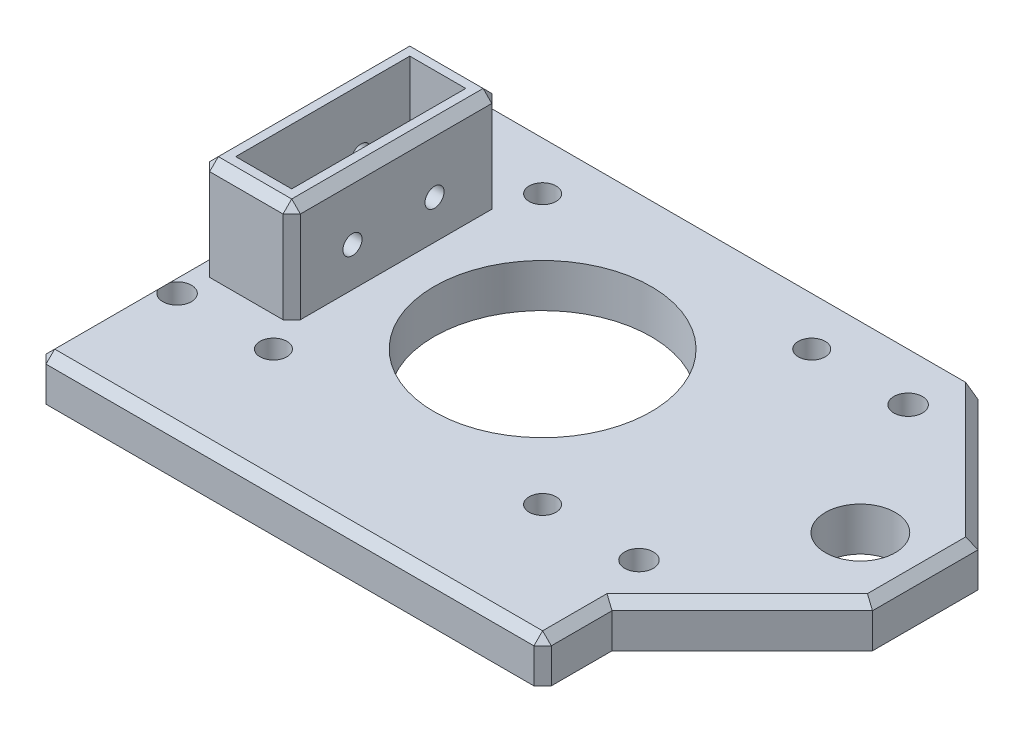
SolidWorks part; units mm, degrees
ref_plane "Alzado" through (0, 0, 0) normal (0, 0, 1) x (1, 0, 0)
ref_plane "Planta" through (0, 0, 0) normal (0, 1, 0) x (1, 0, 0)
ref_plane "Vista lateral" through (0, 0, 0) normal (1, 0, 0) x (0, 0, -1)
sketch "Croquis1" plane through (0, 10.1619, 0) normal (0, 1, 0) x (1, 0, 0)
  line L1 (26.3958, -1000.05) -> (-31.8042, -1000.05)
  line L2 (26.3958, -1000.05) -> (26.3958, -1050.2)
  line L3 (26.3958, -1050.2) -> (-31.8042, -1050.2)
  line L4 (-31.8042, -1000.05) -> (-31.8042, -1050.2)
  line L8 (25.3958, -1050.2) -> (-30.8042, -1050.2) construction
  line L9 (-26.8042, -1000.05) -> (-31.8042, -1000.05) construction
  line L10 (26.3958, -1049.2) -> (26.3958, -1000.05) construction
  line L11 (-31.8042, -1049.2) -> (-31.8042, -1000.05) construction
  circle A0 centre (-2.7042, -1021.1) radius 12.5
  dimension "D1" = 25
extrude "Saliente-Extruir1" add sketch "Croquis1" along normal blind 5
sketch "Croquis2" plane through (0, 15.1619, 0) normal (0, 1, 0) x (1, 0, 0)
  circle A0 centre (-29.3042, -1005.6) radius 1.65
  circle A1 centre (-29.3042, -1036.6) radius 1.65
  circle A2 centre (23.8958, -1005.6) radius 1.65
  circle A3 centre (23.8958, -1036.6) radius 1.65
  dimension "D1" = 3.3
  dimension "D2" = 3.3
  dimension "D3" = 3.3
  dimension "D4" = 3.3
extrude "Cortar-Extruir1" cut sketch "Croquis2" against normal up to next
sketch "Croquis3" plane through (0, 15.1619, 0) normal (0, 1, 0) x (1, 0, 0)
  line L8 (13.4673, -1042.2) -> (-18.8758, -1042.2) construction
  line L9 (26.3958, -1050.2) -> (26.3958, -1000.05) construction
  line L10 (26.3958, -1042.2) -> (26.3958, -1000.05)
  line L11 (26.3958, -1042.2) -> (41.3958, -1027.2)
  line L12 (41.3958, -1027.2) -> (41.3958, -1015.05)
  line L13 (41.3958, -1015.05) -> (26.3958, -1000.05)
  circle A1 centre (33.8958, -1021.1) radius 4.025
  dimension "D9" = 8.05
  dimension "D6" = 15
  dimension "D7" = 45
  dimension "D8" = 45
  dimension "D10" = 7.5
extrude "Saliente-Extruir2" add sketch "Croquis3" against normal up to vertex
chamfer "Chaflán2" distance 1 angle 45 8 edges at (26.3958, 15.1619, 1046.2) (-31.8042, 12.6619, 1050.2) (-31.8042, 15.1619, 1025.125) (-2.7042, 15.1619, 1050.2) (26.3958, 12.6619, 1050.2) (33.8958, 15.1619, 1007.55) (41.3958, 15.1619, 1021.125) (33.8958, 15.1619, 1034.7)
ref_plane "Plano1" through (-23.7542, 3.1619, 1035.1195) normal (0, 0, 1) x (1, 0, 0)
sketch "Croquis7" plane through (0, 15.1619, 0) normal (0, 1, 0) x (1, 0, 0)
  circle A0 centre (-18.2042, -1005.6) radius 1.55
  circle A1 centre (12.7958, -1005.6) radius 1.55
  circle A2 centre (-18.2042, -1036.6) radius 1.55
  circle A3 centre (12.7958, -1036.6) radius 1.55
  dimension "D1" = 3.1
  dimension "D2" = 3.1
  dimension "D3" = 3.1
  dimension "D4" = 3.1
extrude "Cortar-Extruir2" cut sketch "Croquis7" against normal up to next
sketch "Croquis8" plane through (0, 15.1619, 0) normal (0, 1, 0) x (1, 0, 0)
  line L0 (-31.8042, -1049.2) -> (-31.8042, -1000.05) construction
  line L1 (-28.0292, -1031.125) -> (-21.5792, -1031.125)
  line L2 (-28.0292, -1031.125) -> (-28.0292, -1011.075)
  line L3 (-28.0292, -1011.075) -> (-21.5792, -1011.075)
  line L4 (-21.5792, -1031.125) -> (-21.5792, -1011.075)
  line L5 (-28.0292, -1031.125) -> (-21.5792, -1011.075) construction
  line L6 (-28.0292, -1011.075) -> (-21.5792, -1031.125) construction
  line L8 (-30.0292, -1033.125) -> (-19.5792, -1033.125)
  line L9 (-30.0292, -1033.125) -> (-30.0292, -1009.075)
  line L10 (-30.0292, -1009.075) -> (-19.5792, -1009.075)
  line L11 (-19.5792, -1033.125) -> (-19.5792, -1009.075)
  line L12 (-30.0292, -1033.125) -> (-19.5792, -1009.075) construction
  line L13 (-30.0292, -1009.075) -> (-19.5792, -1033.125) construction
  point P0 (-24.8042, -1021.1)
  point P16 (-24.8042, -1021.1)
  dimension "D1" = 6.45
  dimension "D2" = 20.05
  dimension "D3" = 7
  dimension "D4" = 2
  dimension "D5" = 2
extrude "Saliente-Extruir4" add sketch "Croquis8" along normal blind 11.55
sketch "Croquis10" plane through (0, 15.1619, 0) normal (0, 1, 0) x (1, 0, 0)
  line L4 (-28.0292, -1011.075) -> (-28.0292, -1031.125)
  line L5 (-28.0292, -1031.125) -> (-21.5792, -1031.125)
  line L6 (-21.5792, -1031.125) -> (-21.5792, -1011.075)
  line L7 (-21.5792, -1011.075) -> (-28.0292, -1011.075)
  line L8 (-28.0292, -1011.075) -> (-28.0292, -1031.125)
  line L9 (-28.0292, -1031.125) -> (-21.5792, -1031.125)
  line L10 (-21.5792, -1031.125) -> (-21.5792, -1011.075)
  line L11 (-21.5792, -1011.075) -> (-28.0292, -1011.075)
  dimension "D1" = 0
extrude "Cortar-Extruir3" cut sketch "Croquis10" against normal blind 3
sketch "Croquis11" plane through (0, 26.7119, 0) normal (0, 1, 0) x (1, 0, 0)
  line L8 (-22.2792, -1011.775) -> (-27.3292, -1011.775)
  line L9 (-27.3292, -1011.775) -> (-27.3292, -1030.425)
  line L10 (-27.3292, -1030.425) -> (-22.2792, -1030.425)
  line L11 (-22.2792, -1030.425) -> (-22.2792, -1011.775)
  line L12 (-22.2792, -1011.775) -> (-27.3292, -1011.775)
  line L13 (-27.3292, -1011.775) -> (-27.3292, -1030.425)
  line L14 (-27.3292, -1030.425) -> (-22.2792, -1030.425)
  line L15 (-22.2792, -1030.425) -> (-22.2792, -1011.775)
  dimension "D1" = 0.7
extrude "Cortar-Extruir4" cut sketch "Croquis11" against normal up to next
sketch "Croquis13" plane through (-30.0292, 0, 0) normal (-1, 0, 0) x (0, 0, 1)
  line L0 (1033.125, 26.7119) -> (1033.125, 15.1619) construction
  line L3 (1021.4, 32.6619) -> (1021.4, 15.1619) construction
  line L4 (1019.2, 32.6619) -> (1023.6, 32.6619) construction
  line L5 (1006.2874, 15.1619) -> (1035.9126, 15.1619) construction
  circle A3 centre (1026.125, 19.6619) radius 1.1
  circle A4 centre (1016.675, 19.6619) radius 1.1
  dimension "D3" = 7
  dimension "D1" = 2.2
  dimension "D4" = 4.5
extrude "Cortar-Extruir5" cut sketch "Croquis13" against normal through all
chamfer "Chaflán3" distance 1 angle 45 8 edges at (-24.8042, 26.7119, 1009.075) (-19.5792, 20.9369, 1009.075) (-30.0292, 20.9369, 1009.075) (-19.5792, 20.9369, 1033.125) (-19.5792, 26.7119, 1021.1) (-30.0292, 26.7119, 1021.1) (-24.8042, 26.7119, 1033.125) (-30.0292, 20.9369, 1033.125)
